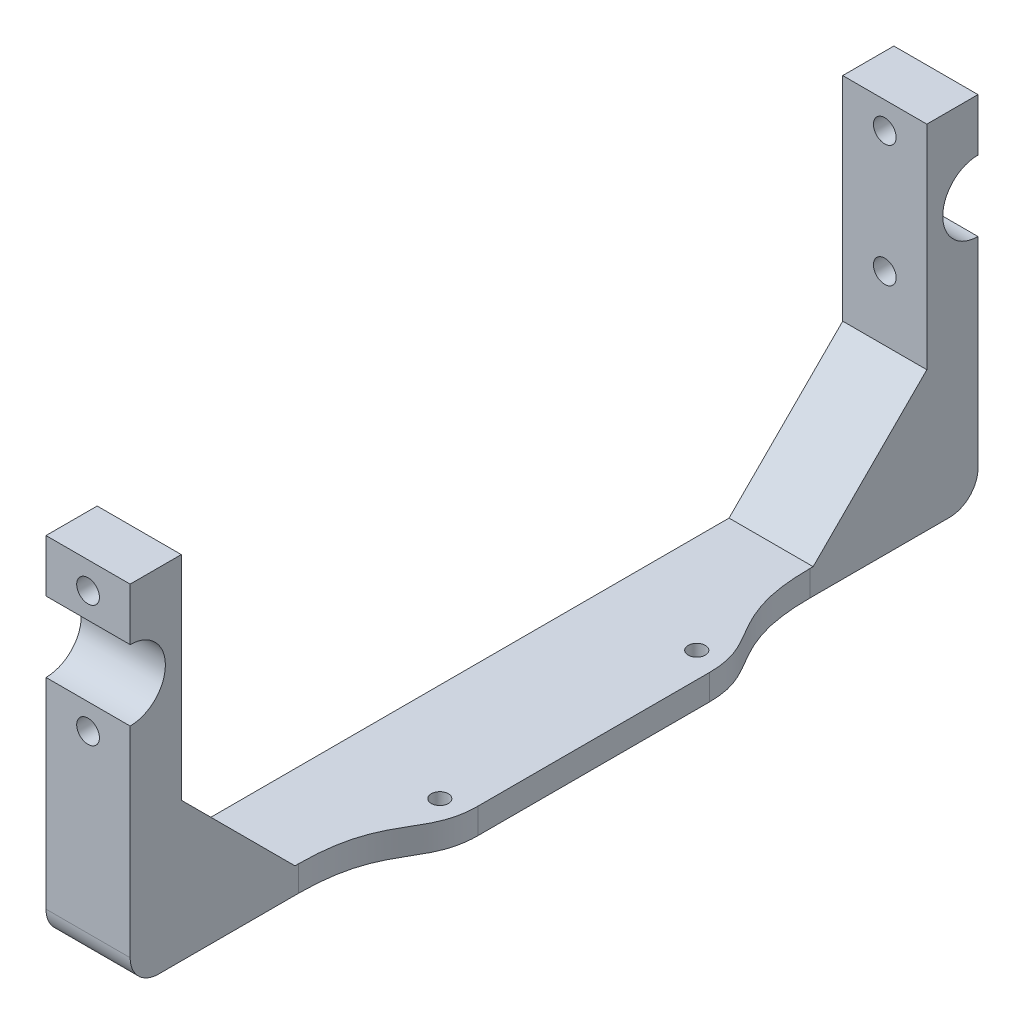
SolidWorks part; units mm, degrees
ref_plane "Front Plane" through (0, 0, 0) normal (0, 0, 1) x (1, 0, 0)
ref_plane "Top Plane" through (0, 0, 0) normal (0, 1, 0) x (1, 0, 0)
ref_plane "Right Plane" through (0, 0, 0) normal (1, 0, 0) x (0, 0, -1)
sketch "Sketch2" plane through (0, 0, 0) normal (1, 0, 0) x (0, 0, -1)
  line L1 (-90, -4.5) -> (90, -4.5)
  line L2 (-90, -4.5) -> (-90, 4.5)
  line L3 (-90, 4.5) -> (90, 4.5)
  line L4 (90, -4.5) -> (90, 4.5)
  line L5 (-90, -4.5) -> (90, 4.5) construction
  line L6 (-90, 4.5) -> (90, -4.5) construction
  point P0 (0, 0)
  dimension "D1" = 9
  dimension "D2" = 180
extrude "Boss-Extrude1" add sketch "Sketch2" along normal blind 14.8
sketch "Sketch3" plane through (14.8, 0, 0) normal (1, 0, 0) x (0, 0, -1)
  line L0 (-90, -4.5) -> (90, -4.5) construction
  line L1 (-74.579, -4.5) -> (74.579, -4.5) construction
  line L7 (90, -4.5) -> (90, 4.5)
  line L8 (90, 4.5) -> (-90, 4.5)
  line L9 (-90, 4.5) -> (-90, -4.5)
  line L10 (-90, -4.5) -> (90, -4.5)
  line L11 (90, -4.5) -> (90, 4.5)
  line L12 (90, 4.5) -> (-90, 4.5)
  line L13 (-90, 4.5) -> (-90, -4.5)
  arc A0 (-68.379, -4.5) -> (-80.779, -4.5) centre (-74.579, -4.5) ccw
  arc A1 (80.779, -4.5) -> (68.379, -4.5) centre (74.579, -4.5) ccw
  point P10 (0, -4.5)
  dimension "D1" = 6.2
  dimension "D2" = 149.158
  dimension "D4" = 0
extrude "Bar Holes" [suppressed] cut sketch "Sketch3" against normal through all
sketch "Sketch6" [suppressed] plane through (0, 4.5, 0) normal (0, 1, 0) x (1, 0, 0)
  line L0 (7.4, 63.879) -> (7.4, -63.879) construction
  line L1 (14.8, 90) -> (0, 90) construction
  line L2 (14.8, -90) -> (0, -90) construction
  line L3 (0, -68.379) -> (14.8, -68.379) construction
  line L4 (0, -80.779) -> (14.8, -80.779) construction
  line L5 (-32.5661, 0) -> (77.6197, 0) construction
  circle A0 centre (7.4, 63.879) radius 2
  circle A1 centre (7.4, -63.879) radius 2
  circle A2 centre (7.4, -85.279) radius 2
  circle A3 centre (7.4, 85.279) radius 2
  circle A4 centre (7.4, -32.5) radius 3.5 construction
  circle A5 centre (7.4, 32.5) radius 3.5 construction
  circle A6 centre (17.2995, 22.6005) radius 1.5 construction
  circle A8 centre (17.2995, 22.6005) radius 5 construction
  point P4 (7.4, 0)
  point P8 (7.4, 90)
  point P17 (7.4, -90)
  dimension "D1" = 4
  dimension "D2" = 4
  dimension "D5" = 4
  dimension "D6" = 4
  dimension "D10" = 7
  dimension "D11" = 7
  dimension "D7" = 32.5
  dimension "D12" = 3
  dimension "D14" = 9.8995
  dimension "D3" = 4.5
  dimension "D4" = 4.5
  dimension "D8" = 4.5
  dimension "D9" = 32.5
  dimension "D13" = 14
extrude "Bolt Holes" [suppressed] cut sketch "Sketch6" against normal through all
sketch "Sketch7" plane through (14.8, 0, 0) normal (1, 0, 0) x (0, 0, -1)
  line L0 (-90, -4.5) -> (90, -4.5) construction
  line L1 (-90, -4.5) -> (90, -4.5)
  line L2 (-90, -4.5) -> (-90, 0)
  line L3 (-90, 0) -> (90, 0)
  line L4 (90, -4.5) -> (90, 0)
  point P6 (0, 0)
  dimension "D1" = 180
extrude "Cut-Extrude1" cut sketch "Sketch7" against normal through all
sketch "Sketch8" plane through (14.8, 0, 0) normal (1, 0, 0) x (0, 0, -1)
  line L1 (90, 4.5) -> (-90, 4.5) construction
  line L3 (45, 0) -> (45, 4.5)
  line L5 (-45, 0) -> (-45, 4.5)
  line L6 (-45, 4.5) -> (45, 4.5)
  line L7 (45, 0) -> (-45, 0)
extrude "Boss-Extrude2" add sketch "Sketch8" along normal blind 7
sketch "Sketch10" plane through (0, 0, 0) normal (0, -1, 0) x (1, 0, 0)
  line L0 (17.2995, -22.6005) -> (7.4, -32.5) construction
  line L1 (-13.7406, 0) -> (37.2021, 0) construction
  line L4 (14.8, -45) -> (14.8, -29.7858) construction
  line L5 (14.8, -29.7858) -> (21.8, -29.7858) construction
  line L6 (21.8, 45) -> (21.8, -45) construction
  line L7 (21.8, -29.7858) -> (21.8, -20.3664) construction
  line L8 (21.8, -20.3664) -> (30.1723, -20.3664)
  line L9 (30.1723, -20.3664) -> (30.1723, -52.0388)
  line L10 (30.1723, -52.0388) -> (14.8, -52.0388)
  line L12 (14.8, -52.0388) -> (14.8, -45)
  line L13 (30.1723, 52.0388) -> (14.8, 52.0388)
  line L14 (30.1723, 20.3664) -> (30.1723, 52.0388)
  line L15 (21.8, 20.3664) -> (30.1723, 20.3664)
  line L16 (14.8, 45) -> (14.8, 29.7858) construction
  line L17 (14.8, 29.7858) -> (21.8, 29.7858) construction
  line L18 (21.8, 29.7858) -> (21.8, 20.3664) construction
  line L19 (14.8, 52.0388) -> (14.8, 45)
  circle A0 centre (17.2995, -22.6005) radius 1.5
  circle A1 centre (7.4, -32.5) radius 3.5 construction
  circle A2 centre (17.2995, 22.6005) radius 1.5
  spline S0 degree 3 poles (14.8, -45) (14.8, -29.7858) (21.8, -29.7858) (21.8, -20.3664) knots 0 0 0 0 1 1 1 1
  spline S1 degree 3 poles (14.8, 45) (14.8, 29.7858) (21.8, 29.7858) (21.8, 20.3664) knots 0 0 0 0 1 1 1 1
  dimension "D1" = 45
  dimension "D2" = 14
extrude "Cut-Extrude2" cut sketch "Sketch10" against normal blind 8
fillet "Fillet1" [suppressed] radius 8
sketch "Sketch11" plane through (14.8, 0, 0) normal (1, 0, 0) x (0, 0, -1)
  line L0 (74.579, 40.3) -> (74.579, 4.5)
  line L1 (65.579, 46.5) -> (65.579, 4.5)
  line L2 (65.579, 46.5) -> (68.379, 46.5) construction
  line L3 (65.579, 46.5) -> (65.579, 61.92)
  line L4 (90, 4.5) -> (45, 4.5) construction
  line L5 (74.579, 4.5) -> (65.579, 4.5)
  line L6 (74.579, 52.7) -> (74.579, 61.92)
  line L7 (74.579, 61.92) -> (65.579, 61.92)
  line L8 (0, -12.2992) -> (0, 49.2749) construction
  line L9 (-74.579, 52.7) -> (-74.579, 61.92)
  line L10 (-74.579, 61.92) -> (-65.579, 61.92)
  line L11 (-65.579, 46.5) -> (-65.579, 61.92)
  line L12 (-65.579, 46.5) -> (-65.579, 4.5)
  line L13 (-74.579, 4.5) -> (-65.579, 4.5)
  line L14 (-74.579, 40.3) -> (-74.579, 4.5)
  arc A0 (74.579, 52.7) -> (74.579, 40.3) centre (74.579, 46.5) ccw
  arc A2 (-74.579, 52.7) -> (-74.579, 40.3) centre (-74.579, 46.5) cw
  dimension "D1" = 9
  dimension "D2" = 42
  dimension "D3" = 15.42
extrude "Boss-Extrude3" add sketch "Sketch11" against normal blind 14.8
sketch "Sketch12" plane through (0, 0, 74.579) normal (0, 0, 1) x (1, 0, 0)
  line L0 (7.4, 61.92) -> (7.4, 52.7) construction
  line L1 (0, 61.92) -> (14.8, 61.92) construction
  line L2 (0, 52.7) -> (14.8, 52.7) construction
  line L3 (7.4, 52.7) -> (7.4, 40.3) construction
  line L4 (0, 40.3) -> (14.8, 40.3) construction
  line L5 (7.4, 46.5) -> (-1.8066, 46.5) construction
  circle A0 centre (7.4, 57.2) radius 2
  circle A1 centre (7.4, 35.8) radius 2
  dimension "D1" = 4.5
extrude "Cut-Extrude3" cut sketch "Sketch12" against normal through all both and the other way through all
sketch "Sketch13" plane through (0, 0, 0) normal (-1, 0, 0) x (0, 0, 1)
  line L0 (74.579, 4.5) -> (74.579, -10.4296)
  line L1 (74.579, -10.4296) -> (100.927, -10.4296)
  line L2 (100.927, -10.4296) -> (100.927, 4.5)
  line L3 (100.927, 4.5) -> (74.579, 4.5)
  line L4 (0, -9.6936) -> (0, 28.4875) construction
  line L5 (-100.927, -10.4296) -> (-100.927, 4.5)
  line L6 (-74.579, -10.4296) -> (-100.927, -10.4296)
  line L7 (-74.579, 4.5) -> (-74.579, -10.4296)
  line L8 (-100.927, 4.5) -> (-74.579, 4.5)
extrude "Cut-Extrude4" cut sketch "Sketch13" against normal through all both
fillet "Fillet2" radius 5 2 edges at (7.4, 0, 74.579) (7.4, 0, -74.579)
chamfer "Chamfer1" distance 20 angle 45 2 edges at (7.4, 4.5, 65.579) (7.4, 4.5, -65.579)
